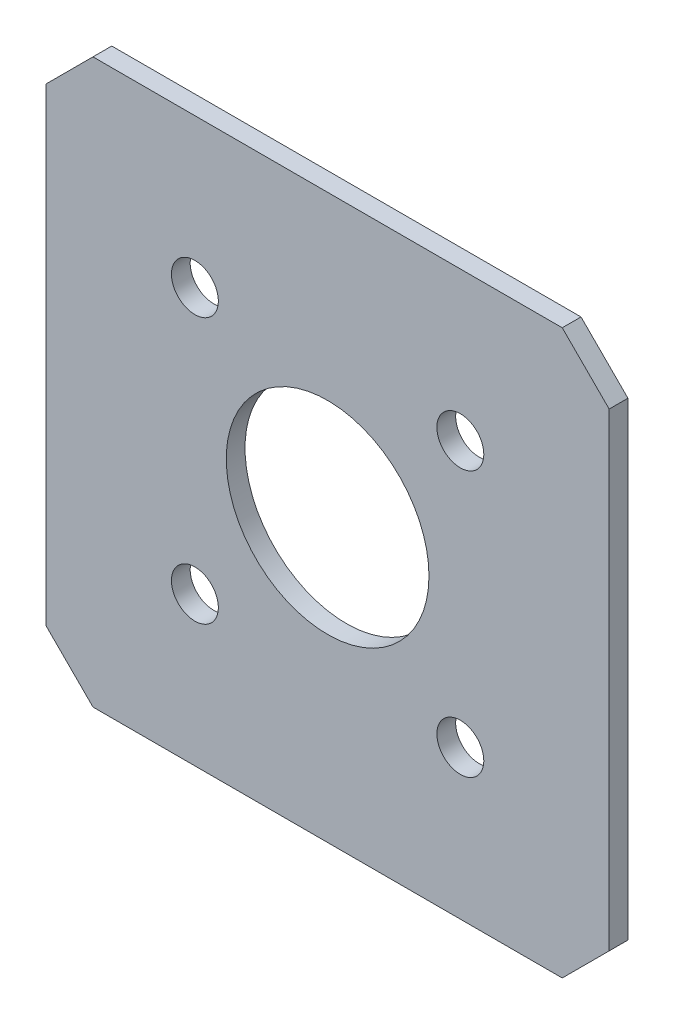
SolidWorks part; units mm, degrees
ref_plane "Plan de face" through (0, 0, 0) normal (0, 0, 1) x (1, 0, 0)
ref_plane "Plan de dessus" through (0, 0, 0) normal (0, 1, 0) x (1, 0, 0)
ref_plane "Plan de droite" through (0, 0, 0) normal (1, 0, 0) x (0, 0, -1)
sketch "Esquisse1" plane through (0, 0, 0) normal (0, 0, 1) x (1, 0, 0)
  line L0 (-150, 125) -> (-125, 150)
  line L1 (-125, 150) -> (125, 150)
  line L2 (-150, 125) -> (-150, -125)
  line L3 (-125, -150) -> (125, -150)
  line L4 (150, 125) -> (150, -125)
  line L5 (-150, 150) -> (150, -150) construction
  line L6 (-150, -150) -> (150, 150) construction
  line L7 (125, 150) -> (150, 125)
  line L8 (125, -150) -> (150, -125)
  line L9 (-150, -125) -> (-125, -150)
  circle A0 centre (0, 0) radius 100 construction
  circle A1 centre (-70.7107, 70.7107) radius 12.5
  circle A2 centre (70.7107, 70.7107) radius 12.5
  circle A3 centre (70.7107, -70.7107) radius 12.5
  circle A4 centre (-70.7107, -70.7107) radius 12.5
  circle A5 centre (0, 0) radius 54
  point P0 (0, 0)
  dimension "D3" = 200
  dimension "D4" = 25
  dimension "D9" = 108
  dimension "D1" = 300
  dimension "D2" = 300
extrude "Boss.-Extru.1" add sketch "Esquisse1" along normal blind 10
